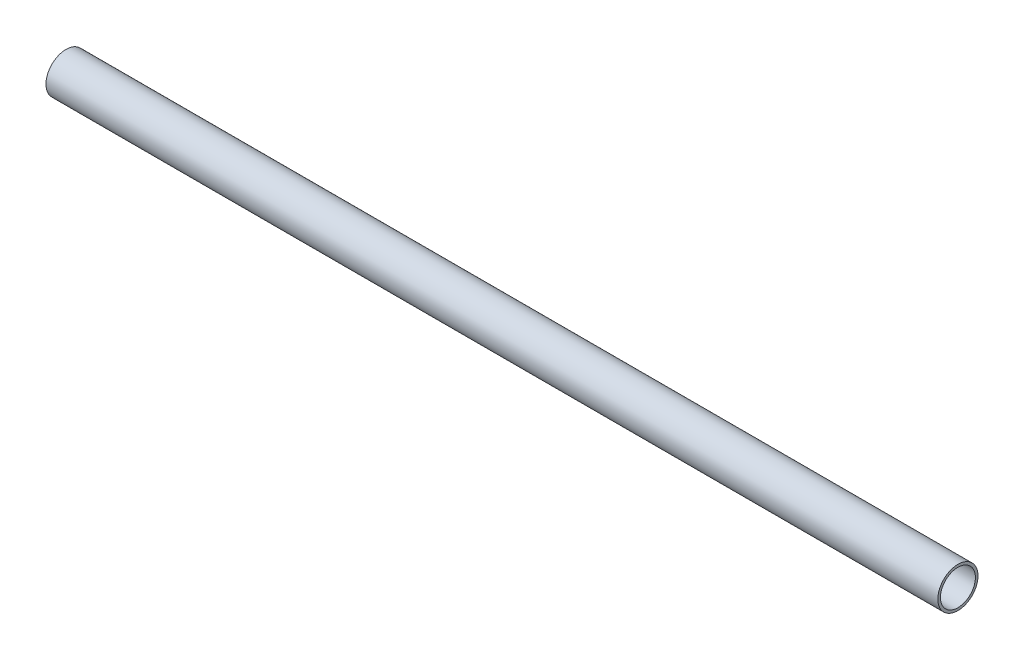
SolidWorks part; units mm, degrees
ref_plane "Front Plane" through (0, 0, 0) normal (0, 0, 1) x (1, 0, 0)
ref_plane "Top Plane" through (0, 0, 0) normal (0, 1, 0) x (1, 0, 0)
ref_plane "Right Plane" through (0, 0, 0) normal (1, 0, 0) x (0, 0, -1)
sketch "Sketch1" plane through (0, 0, 0) normal (0, 0, 1) x (1, 0, 0)
  line L0 (161.925, 7.2898) -> (-161.925, 7.2898)
  line L1 (-161.925, 6.35) -> (161.925, 6.35)
  line L2 (161.925, 6.35) -> (161.925, 7.2898)
  line L3 (88.8575, 0) -> (-99.2718, 0) construction
  line L4 (-161.925, 7.2898) -> (-161.925, 6.35)
  point P7 (0, 6.35)
  dimension "D1" = 12.7
  dimension "D2" = 0.9398
  dimension "D3" = 323.85
revolve "Revolve1" add sketch "Sketch1" angle 360 about L3
